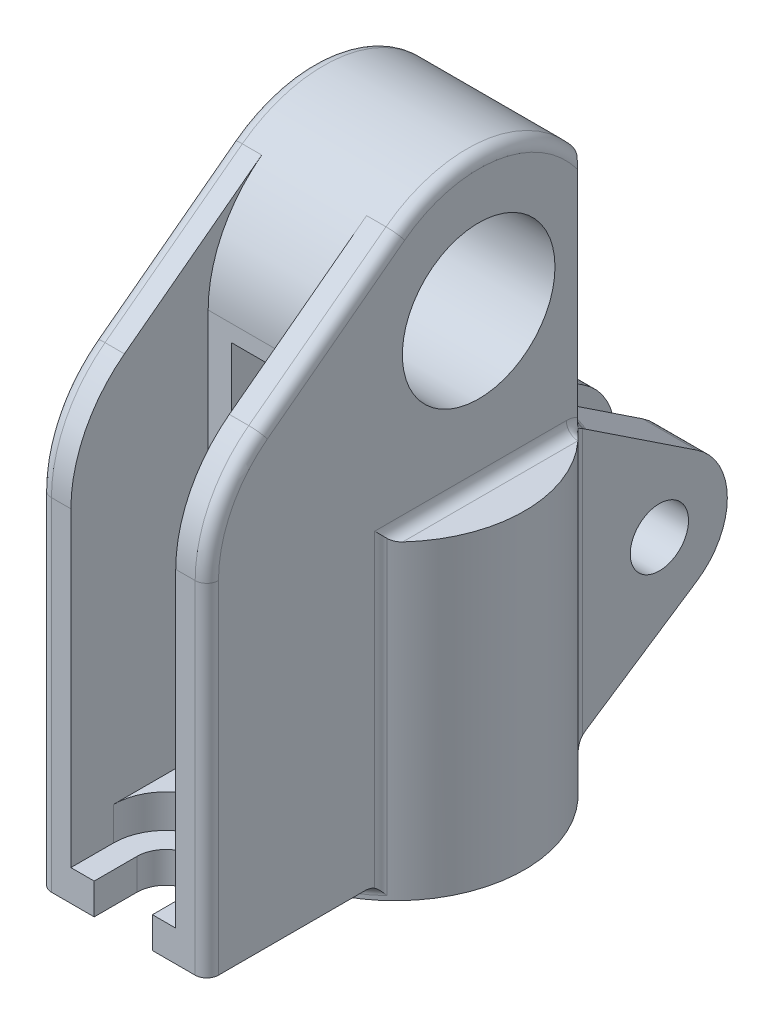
SolidWorks part; units mm, degrees
ref_plane "Front" through (0, 0, 0) normal (0, 0, 1) x (1, 0, 0)
ref_plane "Top" through (0, 0, 0) normal (0, 1, 0) x (1, 0, 0)
ref_plane "Right" through (0, 0, 0) normal (1, 0, 0) x (0, 0, -1)
sketch "Sketch1" plane through (0, 0, 0) normal (0, 1, 0) x (1, 0, 0)
  circle A0 centre (0, 0) radius 8.4582
  dimension "D1" = 16.9164
extrude "Boss-Extrude1" add sketch "Sketch1" along normal blind 20.32
sketch "Sketch2" plane through (0, 0, 0) normal (1, 0, 0) x (0, 0, -1)
  line L0 (3.9681, 1.0414) -> (-17.78, 1.0414)
  line L1 (-17.78, 1.0414) -> (-17.78, 23.3934)
  line L2 (-14.277, 30.4211) -> (-5.2981, 37.1902)
  line L3 (-8.4582, 0) -> (8.4582, 0) construction
  line L4 (8.7956, 29.8511) -> (8.4582, 20.32)
  line L5 (0, 30.1625) -> (0, 0) construction
  line L6 (3.9681, 1.0414) -> (3.9681, 5.4768)
  line L7 (3.9681, 5.4768) -> (8.4582, 20.32)
  arc A0 (8.7956, 29.8511) -> (-5.2981, 37.1902) centre (0, 30.1625) ccw
  arc A1 (-17.78, 23.3934) -> (-14.277, 30.4211) centre (-8.9789, 23.3934) cw
  circle A2 centre (0, 30.1625) radius 4.9911
  dimension "D1" = 30.1625
  dimension "D4" = 9.9822
  dimension "D5" = 3.81
  dimension "D2" = 1.0414
  dimension "D3" = 17.78
  dimension "D6" = 22.352
extrude "Boss-Extrude2" add sketch "Sketch2" along normal mid plane 10.922
sketch "Sketch3" plane through (0, 0, 0) normal (0, -1, 0) x (1, 0, 0)
  line L0 (8.2053, -2.0528) -> (14.103, -2.0528)
  line L1 (-12.3941, -2.0528) -> (-8.2053, -2.0528)
  line L2 (-12.3941, -2.0528) -> (-12.3941, -13.4435)
  line L3 (-12.3941, -13.4435) -> (14.103, -13.4435)
  line L4 (14.103, -2.0528) -> (14.103, -13.4435)
  line L5 (-12.3941, -2.0528) -> (14.103, -13.4435) construction
  line L6 (-12.3941, -13.4435) -> (14.103, -2.0528) construction
  circle A1 centre (0, 0) radius 8.4582
  arc A2 (-8.2053, -2.0528) -> (8.2053, -2.0528) centre (0, 0) ccw
  point P7 (0.8545, -7.7482)
  dimension "D1" = 0
extrude "Cut-Extrude1" cut sketch "Sketch3" against normal through all
sketch "Sketch4" plane through (0, 0, 0) normal (1, 0, 0) x (0, 0, -1)
  line L0 (6.459, 20.32) -> (16.2624, 13.8151) construction
  line L1 (16.2624, 13.8151) -> (16.2624, 9.0449) construction
  line L2 (16.2624, 9.0449) -> (6.459, 2.54) construction
  line L3 (6.459, 20.32) -> (14.275, 15.1338)
  line L4 (14.275, 7.7262) -> (6.459, 2.54)
  line L5 (-8.4582, 0) -> (8.4582, 0) construction
  line L6 (6.459, 20.32) -> (6.459, 2.54)
  arc A0 (14.275, 15.1338) -> (14.275, 7.7262) centre (11.8174, 11.43) cw
  circle A1 centre (11.8174, 11.43) radius 1.905
extrude "Boss-Extrude3" add sketch "Sketch4" along normal mid plane 10.922
sketch "Sketch5" plane through (0, 0, 0) normal (1, 0, 0) x (0, 0, -1)
  line L0 (-8.8011, 30.1625) -> (-8.8011, 5.2578)
  line L1 (-17.78, 1.0414) -> (-6.459, 1.0414) construction
  line L2 (-8.8011, 5.2578) -> (-17.78, 5.2578)
  line L6 (6.459, 20.32) -> (6.459, 36.1409)
  line L7 (-5.2981, 37.1902) -> (-14.277, 30.4211)
  line L8 (-17.78, 23.3934) -> (-17.78, 1.0414)
  line L9 (-17.78, 1.0414) -> (-6.459, 1.0414)
  line L10 (-6.459, 1.0414) -> (-6.459, 20.32)
  line L11 (-6.459, 20.32) -> (6.459, 20.32)
  line L13 (-5.2981, 37.1902) -> (-14.277, 30.4211)
  line L14 (-17.78, 23.3934) -> (-17.78, 5.2578)
  arc A0 (-5.2981, 37.1902) -> (-8.8011, 30.1625) centre (0, 30.1625) ccw
  arc A2 (6.459, 36.1409) -> (-5.2981, 37.1902) centre (0, 30.1625) ccw
  arc A3 (-14.277, 30.4211) -> (-17.78, 23.3934) centre (-8.9789, 23.3934) ccw
  arc A4 (6.459, 36.1409) -> (-5.2981, 37.1902) centre (0, 30.1625) ccw construction
  arc A5 (-14.277, 30.4211) -> (-17.78, 23.3934) centre (-8.9789, 23.3934) ccw
  circle A8 centre (0, 30.1625) radius 4.9911 construction
  dimension "D2" = 4.2164
  dimension "D1" = 0
extrude "Cut-Extrude2" cut sketch "Sketch5" against normal mid plane 6.858
sketch "Sketch6" plane through (0, 0, 0) normal (1, 0, 0) x (0, 0, -1)
  line L0 (-16.2594, 33.3589) -> (6.459, 20.32)
  line L1 (8.4582, 8.1026) -> (-22.5702, 8.1026)
  line L2 (-8.4582, 0) -> (8.4582, 0) construction
  line L3 (-16.2594, 33.3589) -> (-22.5702, 8.1026)
  line L4 (6.459, 20.32) -> (6.459, 2.54)
  line L5 (6.459, 2.54) -> (14.275, 7.7262)
  line L6 (14.275, 15.1338) -> (6.459, 20.32)
  line L8 (8.4582, 3.8665) -> (14.275, 7.7262)
  line L9 (14.275, 15.1338) -> (6.459, 20.32)
  line L10 (-8.4582, 0) -> (8.4582, 0) construction
  line L11 (8.4582, 0) -> (8.4582, 8.1026)
  arc A0 (6.459, 36.1409) -> (-5.2981, 37.1902) centre (0, 30.1625) ccw construction
  arc A1 (14.275, 7.7262) -> (14.275, 15.1338) centre (11.8174, 11.43) ccw
  arc A2 (14.275, 7.7262) -> (14.275, 15.1338) centre (11.8174, 11.43) ccw
  dimension "D2" = 14.1224
  dimension "D3" = 8.1026
  dimension "D1" = 0
extrude "Cut-Extrude3" cut sketch "Sketch6" against normal mid plane 3.81 contours L8 A2 L9 L0 L3 L1 L11
chamfer "Chamfer1" distance 1.778 angle 45 1 edges at (0, 8.1026, 8.8011)
sketch "Sketch7" plane through (0, 0, 0) normal (0, -1, 0) x (1, 0, 0)
  line L0 (-1.905, -8.4582) -> (0, -8.4582) construction
  line L1 (0, -8.4582) -> (1.905, -8.4582) construction
  line L2 (-1.905, -8.4582) -> (0, -8.4582)
  line L3 (0, -8.4582) -> (1.905, -8.4582)
  line L4 (-1.905, -8.4582) -> (-1.905, -8.2409)
  line L5 (1.905, -8.4582) -> (1.905, -8.2409)
  circle A1 centre (0, 0) radius 8.4582
  arc A2 (-1.905, -8.2409) -> (1.905, -8.2409) centre (0, 0) ccw
  dimension "D1" = 0
extrude "Cut-Extrude4" cut sketch "Sketch7" against normal up to next contours L4 L2 M2 | L3 L5 M2
sketch "Sketch8" plane through (0, 5.2578, 0) normal (0, 1, 0) x (1, 0, 0)
  line L0 (-3.429, -5.2981) -> (-3.429, -14.277) construction
  line L1 (3.429, -17.78) -> (3.429, -8.8011) construction
  line L2 (-3.429, -17.78) -> (-3.429, -8.8011) construction
  line L3 (-3.429, -17.78) -> (3.429, -17.78) construction
  line L4 (-3.429, -14.986) -> (-3.429, -17.78)
  line L5 (-3.429, -17.78) -> (3.429, -17.78)
  line L6 (3.429, -17.78) -> (3.429, -14.986)
  arc A0 (-3.429, -14.986) -> (3.429, -14.986) centre (0, -14.986) cw
  dimension "D1" = 2.794
extrude "Cut-Extrude5" cut sketch "Sketch8" against normal offset from surface (2.1844 mm away) 2.032 contours A0 L6 L5 L4
sketch "Sketch10" plane through (0, 3.0734, 0) normal (0, 1, 0) x (1, 0, 0)
  line L0 (-3.429, -14.986) -> (3.429, -14.986) construction
  line L1 (-1.905, -14.986) -> (-1.905, -17.78)
  line L2 (3.429, -17.78) -> (-3.429, -17.78) construction
  line L3 (-1.905, -17.78) -> (1.905, -17.78)
  line L4 (1.905, -17.78) -> (1.905, -14.986)
  arc A0 (1.905, -14.986) -> (-1.905, -14.986) centre (0, -14.986) ccw
  arc A1 (3.429, -14.986) -> (-3.429, -14.986) centre (0, -14.986) ccw construction
  dimension "D1" = 3.81
extrude "Cut-Extrude6" cut sketch "Sketch10" against normal blind 2.032
hole_wizard "M10x1.0 Tapped Hole1" positions "3DSketch1" profile "Sketch11" tap size "M10x1.0" standard "ANSI Metric"
sketch3d "3DSketch1"
  point P0 (0, 0, 0)
  point P4 (0, 0, 0)
sketch "Sketch11" plane through (0, 0, 0) normal (1, 0, 0) x (0, 0, -1)
  line L0 (0, 0) -> (0, 14.8959)
  line L1 (0, 14.8959) -> (4.5, 12.192)
  line L2 (4.5, 12.192) -> (4.5, 0)
  line L5 (4.5, 0) -> (0, 0)
  line L10 (0, 14.8959) -> (-4.5, 12.192) construction
  line L11 (0, -6.35) -> (0, 107.95) construction
  dimension "Tap Drill Dia." = 9
  dimension "Tap Drill Depth" = 12.192
  dimension "Drill Angle" = 118
fillet "Fillet1" radius 0.762 4 edges at (5.461, 10.6807, 6.459) (-5.461, 10.6807, 6.459) (-5.461, 11.43, -6.459) (5.461, 11.43, -6.459)
fillet "Fillet2" radius 0.762 16 edges at (5.461, 38.9288, -0.7824) (5.461, 12.2174, 17.78) (5.461, 27.3196, 16.8557) (-5.461, 38.9288, -0.7824) (-5.461, 12.2174, 17.78) (-5.461, 27.3196, 16.8557) (0, 1.0414, 8.4582) (5.461, 33.8057, 9.7876) (-5.461, 33.8057, 9.7876) (0.3416, 32.6191, -8.4513) (-3.936, 3.2219, -7.4866) (3.936, 3.2219, -7.4866) (-5.461, 20.32, 0.1722) (-3.7892, 19.5882, -7.5619) (3.7892, 19.5882, -7.5619) (5.461, 20.32, 0.1722)
equation "\"D2@Sketch4\"=\"D1@Sketch4\""
